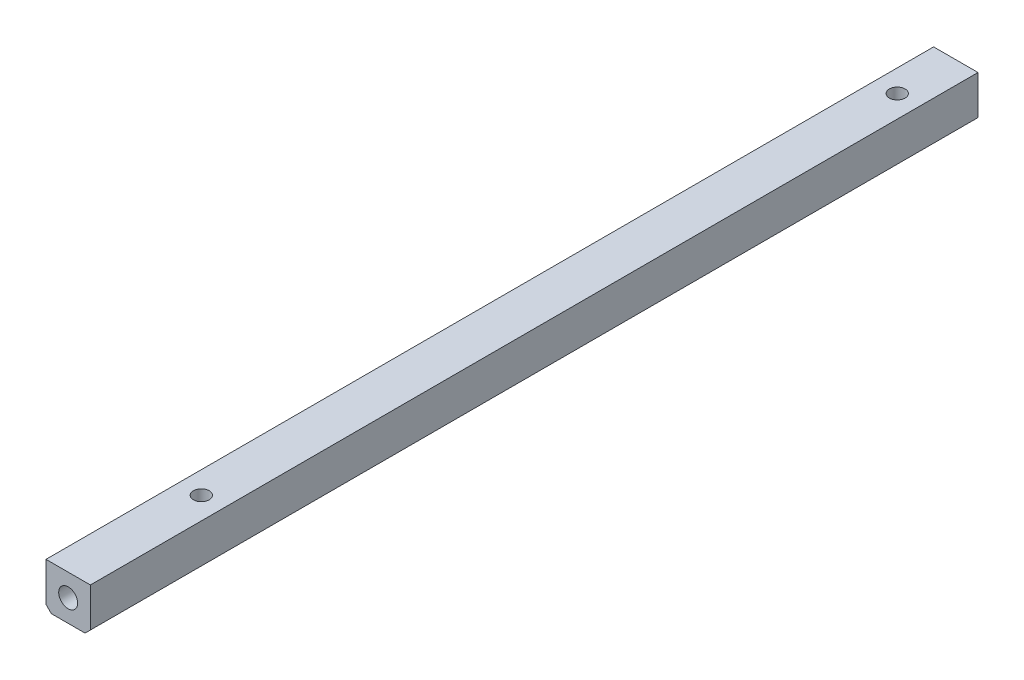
SolidWorks part; units mm, degrees
ref_plane "Front Plane" through (0, 0, 0) normal (0, 0, 1) x (1, 0, 0)
ref_plane "Top Plane" through (0, 0, 0) normal (0, 1, 0) x (1, 0, 0)
ref_plane "Right Plane" through (0, 0, 0) normal (1, 0, 0) x (0, 0, -1)
sketch "Sketch1" plane through (0, 0, 0) normal (0, 0, 1) x (1, 0, 0)
  line L1 (0, 0) -> (6.35, 0)
  line L2 (0, 0) -> (0, 6.35)
  line L3 (0, 6.35) -> (6.35, 6.35)
  line L4 (6.35, 0) -> (6.35, 6.35)
  dimension "D1" = 6.35
  dimension "D2" = 6.35
extrude "bar" add sketch "Sketch1" along normal blind 127
sketch "Sketch2" plane through (0, 6.35, 0) normal (0, 1, 0) x (-1, 0, 0)
  line L0 (-3.175, 127) -> (-3.175, 0) construction
  line L1 (-6.35, 127) -> (0, 127) construction
  line L2 (-6.35, 0) -> (0, 0) construction
  circle A0 centre (-3.175, 107.95) radius 1.1303
  circle A1 centre (-3.175, 8.382) radius 1.1303
other "AlignGroup1" parameters "D1"=2.0867, "D2"=2.2606, "D3"=0, "D4"=19.05, "D5"=118.618, "D6"=127
extrude "Cut-Extrude1" cut sketch "Sketch2" against normal through all
sketch "Sketch3" plane through (0, 0, 127) normal (0, 0, 1) x (1, 0, 0)
  line L0 (3.175, 6.35) -> (3.175, 0) construction
  line L1 (6.35, 6.35) -> (0, 6.35) construction
  line L2 (0, 0) -> (6.35, 0) construction
  circle A0 centre (3.175, 3.175) radius 1.3589
  dimension "D1" = 2.7178
extrude "Cut-Extrude2" cut sketch "Sketch3" against normal blind 12.7
sketch "Sketch4" plane through (0, 0, 0) normal (0, 0, -1) x (-1, 0, 0)
  line L0 (-3.175, 0) -> (-3.175, 6.35) construction
  line L1 (0, 0) -> (-6.35, 0) construction
  line L2 (-6.35, 6.35) -> (0, 6.35) construction
  circle A0 centre (-3.175, 3.175) radius 1.1303
  dimension "D1" = 2.2606
extrude "Cut-Extrude3" cut sketch "Sketch4" against normal blind 10.16
chamfer "Chamfer1" distance 0.762 angle 45 2 edges at (6.35, 0, 63.5) (0, 0, 63.5)
